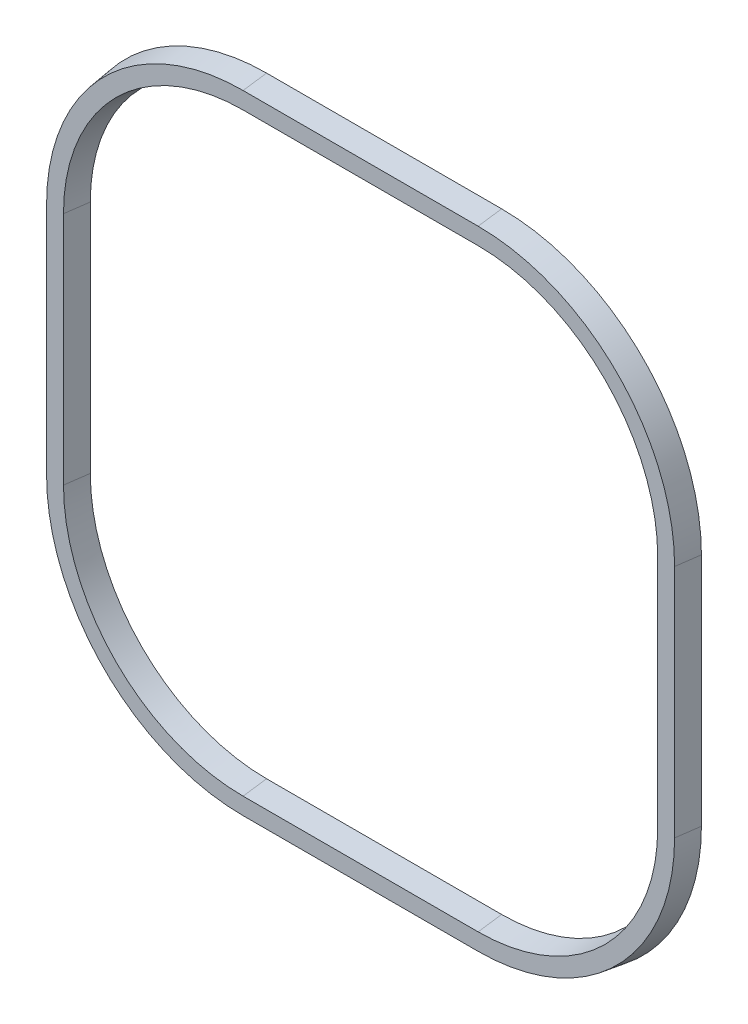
SolidWorks part; units mm, degrees
ref_plane "Front Plane" through (0, 0, 0) normal (0, 0, 1) x (1, 0, 0)
ref_plane "Top Plane" through (0, 0, 0) normal (0, 1, 0) x (1, 0, 0)
ref_plane "Right Plane" through (0, 0, 0) normal (1, 0, 0) x (0, 0, -1)
sketch "Sketch1" plane through (0, 0, 0) normal (0, 0, 1) x (1, 0, 0)
  line L8 (23.075, 10) -> (43.075, 10)
  line L9 (8.075, 45) -> (8.075, 25)
  line L10 (43.075, 60) -> (23.075, 60)
  line L11 (58.075, 25) -> (58.075, 45)
  line L16 (43.075, 62) -> (23.075, 62)
  line L17 (6.075, 45) -> (6.075, 25)
  line L18 (23.075, 8) -> (43.075, 8)
  line L19 (60.075, 25) -> (60.075, 45)
  arc A8 (8.075, 25) -> (23.075, 10) centre (23.075, 25) ccw
  arc A9 (23.075, 60) -> (8.075, 45) centre (23.075, 45) ccw
  arc A10 (58.075, 45) -> (43.075, 60) centre (43.075, 45) ccw
  arc A11 (43.075, 10) -> (58.075, 25) centre (43.075, 25) ccw
  arc A16 (60.075, 45) -> (43.075, 62) centre (43.075, 45) ccw
  arc A17 (23.075, 62) -> (6.075, 45) centre (23.075, 45) ccw
  arc A18 (6.075, 25) -> (23.075, 8) centre (23.075, 25) ccw
  arc A19 (43.075, 8) -> (60.075, 25) centre (43.075, 25) ccw
  point P2 (0, 0)
extrude "Boss-Extrude1" add sketch "Sketch1" along normal blind 2 draft 8
